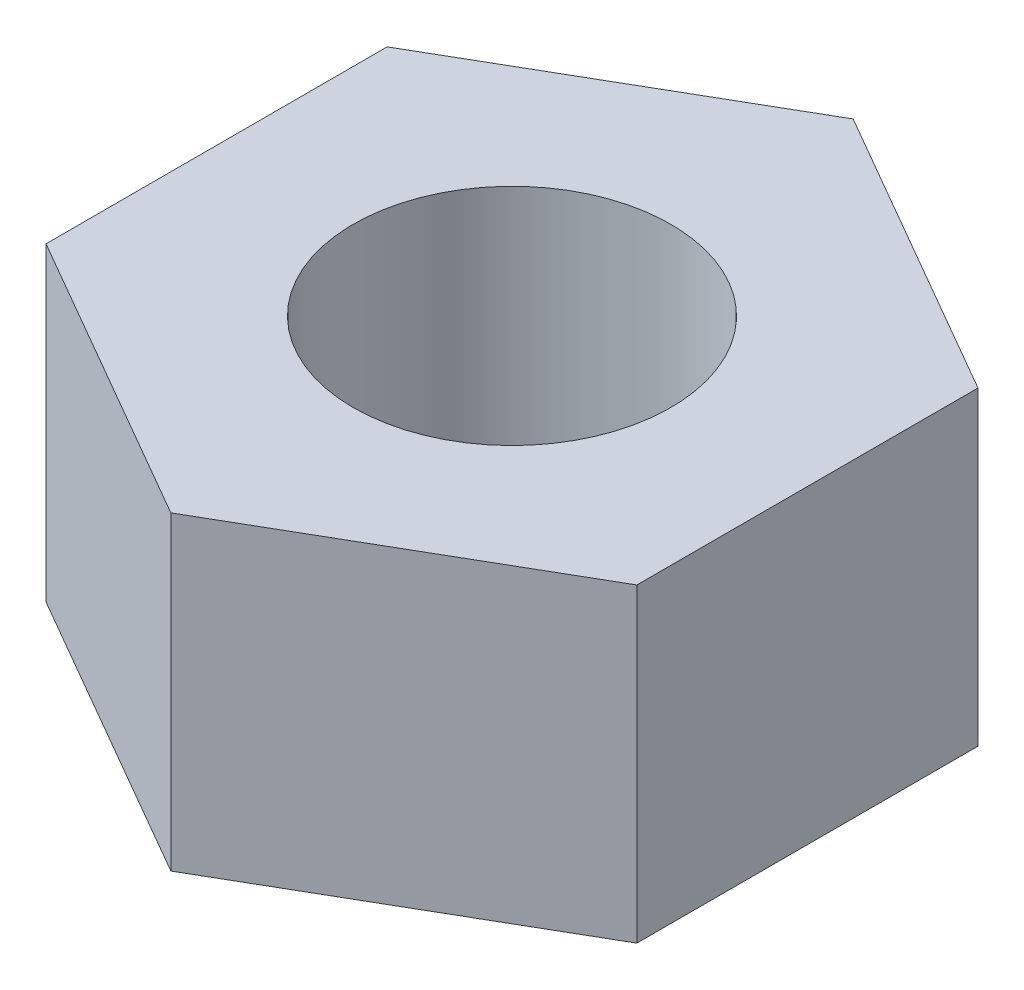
SolidWorks part; units mm, degrees
ref_plane "Front Plane" through (0, 0, 0) normal (0, 0, 1) x (1, 0, 0)
ref_plane "Top Plane" through (0, 0, 0) normal (0, 1, 0) x (1, 0, 0)
ref_plane "Right Plane" through (0, 0, 0) normal (1, 0, 0) x (0, 0, -1)
sketch "Sketch1" plane through (0, 0, 0) normal (0, 1, 0) x (1, 0, 0)
  line L1 (0, 5.8659) -> (-5.08, 2.9329)
  line L2 (-5.08, 2.9329) -> (-5.08, -2.9329)
  line L3 (-5.08, -2.9329) -> (0, -5.8659)
  line L4 (0, -5.8659) -> (5.08, -2.9329)
  line L5 (5.08, -2.9329) -> (5.08, 2.9329)
  line L6 (5.08, 2.9329) -> (0, 5.8659)
  circle A0 centre (0, 0) radius 5.08 construction
  circle A1 centre (0, 0) radius 2.7305
  dimension "D2" = 5.461
  dimension "D1" = 10.16
extrude "Boss-Extrude1" add sketch "Sketch1" along normal blind 5.334
